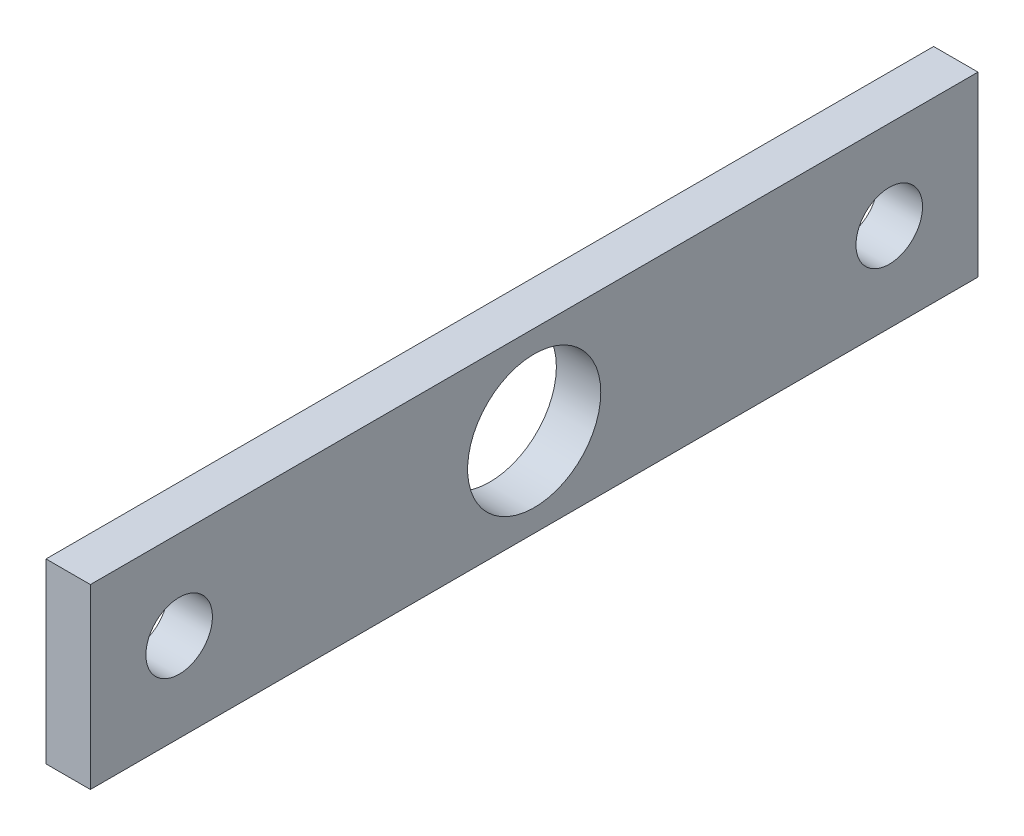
SolidWorks part; units mm, degrees
ref_plane "Front Plane" through (0, 0, 0) normal (0, 0, 1) x (1, 0, 0)
ref_plane "Top Plane" through (0, 0, 0) normal (0, 1, 0) x (1, 0, 0)
ref_plane "Right Plane" through (0, 0, 0) normal (1, 0, 0) x (0, 0, -1)
sketch "Sketch1" plane through (0, 0, 0) normal (1, 0, 0) x (0, 0, -1)
  line L0 (0, 0) -> (63.5, -12.7) construction
  line L1 (0, 0) -> (63.5, 0)
  line L2 (0, 0) -> (0, -12.7)
  line L3 (0, -12.7) -> (63.5, -12.7)
  line L4 (63.5, 0) -> (63.5, -12.7)
  line L5 (63.5, 0) -> (0, -12.7) construction
  line L6 (6.35, -6.35) -> (57.15, -6.35) construction
  circle A0 centre (6.35, -6.35) radius 2.3813
  circle A1 centre (57.15, -6.35) radius 2.3813
  circle A2 centre (31.75, -6.35) radius 4.7625
  point P5 (31.75, -6.35)
  dimension "D3" = 4.7625
  dimension "D4" = 50.8
  dimension "D5" = 9.525
  dimension "D1" = 63.5
  dimension "D2" = 12.7
extrude "Boss-Extrude1" add sketch "Sketch1" along normal blind 3.175
